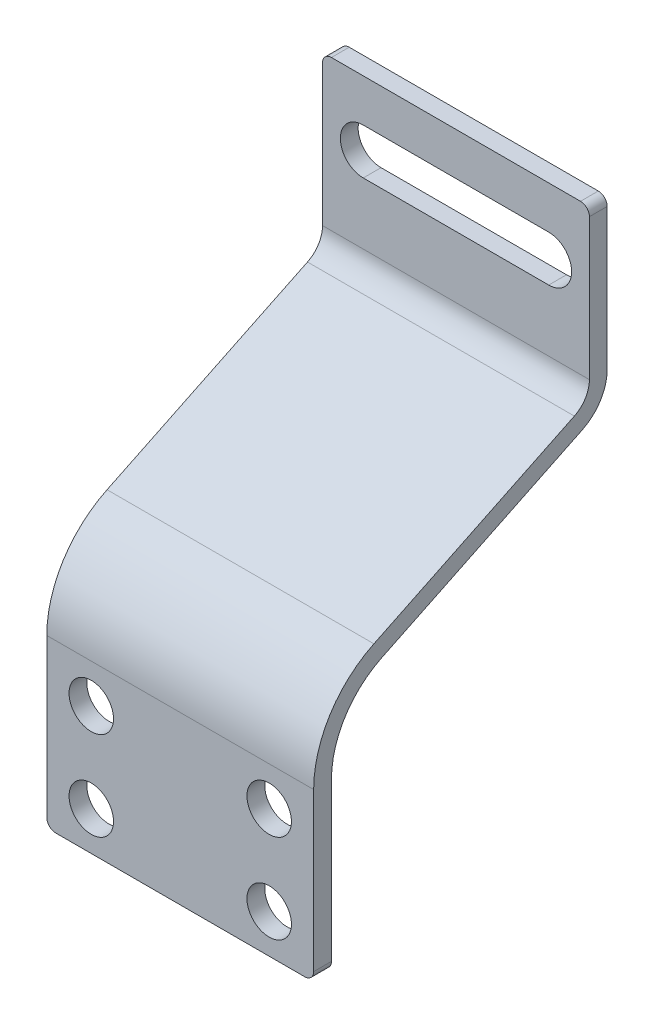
SolidWorks part; units mm, degrees
ref_plane "Front Plane" through (0, 0, 0) normal (0, 0, 1) x (1, 0, 0)
ref_plane "Top Plane" through (0, 0, 0) normal (0, 1, 0) x (1, 0, 0)
ref_plane "Right Plane" through (0, 0, 0) normal (1, 0, 0) x (0, 0, -1)
sketch "Sketch1" plane through (0, 0, 0) normal (1, 0, 0) x (0, 0, -1)
  line L0 (-96.0078, 0) -> (96.0078, 0) construction
  line L2 (-2, 40) -> (2, 40)
  line L3 (2, 40) -> (2, 6.2704)
  line L5 (-3.6444, -2.7312) -> (-48.7112, -24.5377)
  line L6 (-60, -42.5409) -> (-60, -80)
  line L7 (-60, -80) -> (-64, -80)
  line L8 (-2, 40) -> (-2, 6.2704)
  line L9 (-5.3866, 0.8695) -> (-50.4535, -20.937)
  line L10 (-64, -42.5409) -> (-64, -80)
  arc A0 (2, 6.2704) -> (-3.6444, -2.7312) centre (-8, 6.2704) cw
  arc A1 (-48.7112, -24.5377) -> (-60, -42.5409) centre (-40, -42.5409) ccw
  arc A2 (-2, 6.2704) -> (-5.3866, 0.8695) centre (-8, 6.2704) cw
  arc A3 (-50.4535, -20.937) -> (-64, -42.5409) centre (-40, -42.5409) ccw
  point P4 (0, 0)
  point P8 (0, 40)
  point P13 (2, 0)
  point P16 (-60, -30)
  dimension "D6" = 10
  dimension "D7" = 20
  dimension "D2" = 4
  dimension "D3" = 62
  dimension "D4" = 50
  dimension "D5" = 30
extrude "Boss-Extrude1" add sketch "Sketch1" along normal mid plane 60 contours L8 A2 L9 A3 L10 L7 L6 A1 L5 A0 L3 L2
sketch "Sketch2" plane through (0, 0, 64) normal (0, 0, 1) x (1, 0, 0)
  line L0 (0, -42.5409) -> (0, -80) construction
  line L1 (30, -42.5409) -> (-30, -42.5409) construction
  line L2 (30, -80) -> (-30, -80) construction
  line L4 (-20, -51.2704) -> (20, -51.2704) construction
  line L5 (-20, -51.2704) -> (-20, -71.2704) construction
  line L6 (-20, -71.2704) -> (20, -71.2704) construction
  line L7 (20, -51.2704) -> (20, -71.2704) construction
  line L8 (-20, -51.2704) -> (20, -71.2704) construction
  line L9 (-20, -71.2704) -> (20, -51.2704) construction
  circle A0 centre (-20, -51.2704) radius 5
  circle A1 centre (20, -51.2704) radius 5
  circle A2 centre (20, -71.2704) radius 5
  circle A3 centre (-20, -71.2704) radius 5
  point P6 (0, -61.2704)
  dimension "D3" = 10
  dimension "D1" = 20
  dimension "D2" = 40
extrude "Cut-Extrude1" cut sketch "Sketch2" against normal blind 40
sketch "Sketch3" plane through (0, 0, 2) normal (0, 0, 1) x (1, 0, 0)
  line L0 (0, 40) -> (0, 6.2704) construction
  line L1 (-20.85, 25.2692) -> (20.85, 25.2692) construction
  line L2 (30, 40) -> (-30, 40) construction
  line L3 (30, 6.2704) -> (-30, 6.2704) construction
  line L4 (-20.85, 30.4192) -> (20.85, 30.4192)
  line L5 (-20.85, 20.1192) -> (20.85, 20.1192)
  arc A0 (-20.85, 30.4192) -> (-20.85, 20.1192) centre (-20.85, 25.2692) ccw
  arc A1 (20.85, 20.1192) -> (20.85, 30.4192) centre (20.85, 25.2692) ccw
  point P8 (0, 25.2692)
  point P13 (0, 0)
  point P14 (-26, 25.2692)
  point P15 (26, 25.2692)
  dimension "D1" = 10.3
  dimension "D2" = 52
extrude "Cut-Extrude2" cut sketch "Sketch3" against normal blind 40
fillet "Fillet1" radius 2 4 edges at (-30, -80, 62) (30, -80, 62) (-30, 40, 0) (30, 40, 0)
